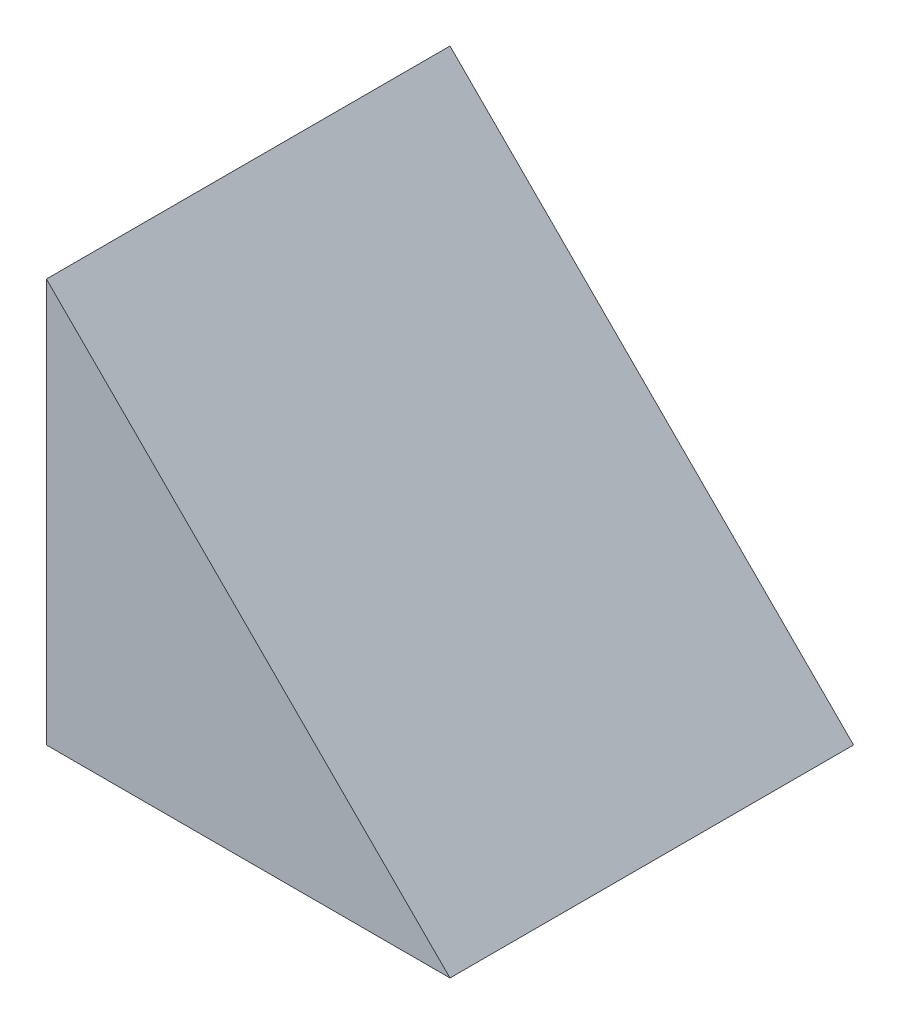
SolidWorks part; units mm, degrees
ref_plane "Front Plane" through (0, 0, 0) normal (0, 0, 1) x (1, 0, 0)
ref_plane "Top Plane" through (0, 0, 0) normal (0, 1, 0) x (1, 0, 0)
ref_plane "Right Plane" through (0, 0, 0) normal (1, 0, 0) x (0, 0, -1)
sketch "Sketch1" plane through (0, 0, 0) normal (0, 0, 1) x (1, 0, 0)
  line L0 (0, 15) -> (15, 0)
  line L1 (0, 0) -> (15, 0)
  line L2 (0, 0) -> (0, 15)
  line L3 (0, 15) -> (15, 15)
  line L4 (15, 0) -> (15, 15)
  dimension "D1" = 15
  dimension "D2" = 15
extrude "Boss-Extrude1" add sketch "Sketch1" along normal blind 15 contours L2 L1 L0
